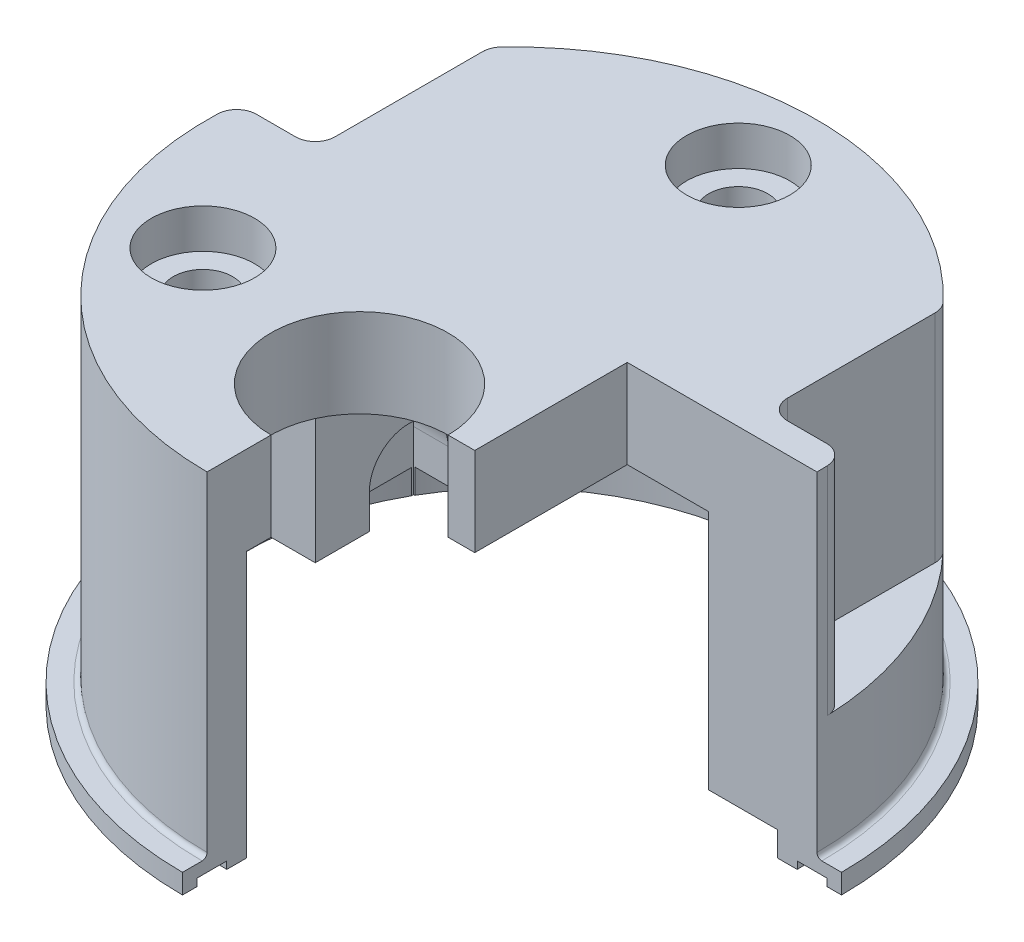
SolidWorks part; units mm, degrees
ref_plane "Face" through (0, 0, 0) normal (0, 0, 1) x (1, 0, 0)
ref_plane "Dessus" through (0, 0, 0) normal (0, 1, 0) x (1, 0, 0)
ref_plane "Droite" through (0, 0, 0) normal (1, 0, 0) x (0, 0, -1)
sketch "Esquisse1" plane through (0, 0, 0) normal (0, 0, 1) x (1, 0, 0)
  line L0 (0, 77.2969) -> (0, -53.1652) construction
  line L1 (-63.5343, 0) -> (62.4031, 0) construction
  line L2 (0, 36) -> (31, 36)
  line L3 (31, 36) -> (31, 2)
  line L4 (31, 2) -> (33.5, 2)
  line L5 (33.5, 2) -> (33.5, 0)
  line L6 (33.5, 0) -> (32, 0)
  line L7 (32, 0) -> (32, 0.75)
  line L8 (32, 0.75) -> (29, 0.75)
  line L9 (29, 0.75) -> (29, 0)
  line L10 (29, 0) -> (27, 0)
  line L11 (27, 0) -> (27, 27)
  line L12 (27, 27) -> (0, 27)
  line L13 (0, 27) -> (0, 36)
  dimension "D1" = 9
  dimension "D2" = 1.5
  dimension "D3" = 3
  dimension "D4" = 2
  dimension "D5" = 4
  dimension "D6" = 6.5
  dimension "D7" = 27
  dimension "D8" = 27
  dimension "D9" = 4
revolve "Base-Révolution" add sketch "Esquisse1" angle 360 about L0
sketch "Esquisse2" plane through (0, 36, 0) normal (0, 1, 0) x (-1, 0, 0)
  line L0 (42.8001, 0) -> (-45.5614, 0) construction
  line L1 (0, -38.1561) -> (0, 39.1602) construction
  line L2 (15.1871, 15.5) -> (-17.6974, 15.5) construction
  circle A0 centre (0, 15.5) radius 9
  dimension "D2" = 18
  dimension "D1" = 15.5
extrude "Enlèv. mat.-Extru.1" cut sketch "Esquisse2" against normal blind 10
sketch "Esquisse7"
  line L0 (0, -33.2189) -> (0, 17.1285) construction
  line L1 (-20, -33.2189) -> (-20, 19.1895) construction
  line L2 (0, 0) -> (-34.9544, 0) construction
  line L3 (-20, -23.5299) -> (-20, 0)
  line L4 (-20, 0) -> (-30.8813, 0)
  line L5 (20, 0) -> (30.8813, 0)
  line L6 (20, -23.5299) -> (20, 0)
  arc A0 (-30.8813, 0) -> (-20, -23.5299) centre (0, 0) ccw
  arc A1 (30.8813, 0) -> (20, -23.5299) centre (0, 0) cw
  dimension "D1" = 20
extrude "Enlèv. mat.-Extru.3" cut sketch "Esquisse4" against normal blind 22
sketch "Esquisse4" plane through (0, 36, 0) normal (0, 1, 0) x (-1, 0, 0)
  line L0 (0, 0) -> (0, -46.4019) construction
  line L1 (0, 0) -> (40.7285, 0) construction
  line L2 (-23, -42.0808) -> (-44.0135, -42.0808)
  line L3 (23, -3) -> (44.0135, -3)
  line L4 (23, -3) -> (23, -42.0808)
  line L5 (23, -42.0808) -> (44.0135, -42.0808)
  line L6 (44.0135, -3) -> (44.0135, -42.0808)
  line L7 (-23, -3) -> (-23, -42.0808)
  line L8 (-23, -3) -> (-44.0135, -3)
  line L9 (-44.0135, -3) -> (-44.0135, -42.0808)
  dimension "D1" = 3
  dimension "D2" = 23
extrude "Boss.-Extru.1" add sketch "Esquisse7" against normal blind 33.5
fillet "Congé1" radius 2
fillet "Congé2" radius 0.5
sketch "Esquisse8" plane through (0, 0, 0) normal (1, 0, 0) x (0, 0, -1)
  line L0 (-15.5, 38.1934) -> (-15.5, 18.6028) construction
  line L1 (-15.5, 27) -> (-15.5, 36) construction
  line L3 (9.5, 41.8102) -> (9.5, -9.6278) construction
  line L4 (-6.2689, 6) -> (23.6039, 6) construction
  line L5 (-27, 0) -> (27, 0) construction
  line L6 (13.5, 6) -> (13.5, -4.6491)
  line L7 (13.5, -4.6491) -> (5.5, -4.6491)
  line L8 (5.5, -4.6491) -> (5.5, 6)
  arc A0 (13.5, 6) -> (5.5, 6) centre (9.5, 6) ccw
  dimension "D3" = 4
  dimension "D1" = 25
  dimension "D2" = 6
extrude "Enlèv. mat.-Extru.4" cut sketch "Esquisse8" against normal mid plane 47
sketch "Esquisse9" plane through (0, 36, 0) normal (0, 1, 0) x (-1, 0, 0)
  line L0 (0, -17.9418) -> (0, -39.9141) construction
  line L1 (8.3859, -23) -> (-15.5366, -23) construction
  circle A0 centre (0, -23) radius 3
  circle A1 centre (-19.9186, 11.5) radius 3
  circle A2 centre (19.9186, 11.5) radius 3
  dimension "D2" = 6
  dimension "D1" = 23
extrude "Enlèv. mat.-Extru.5" cut sketch "Esquisse9" against normal blind 500
sketch "Esquisse10" plane through (0, 36, 0) normal (0, 1, 0) x (-1, 0, 0)
  circle A0 centre (0, -23) radius 5.25
  circle A1 centre (-19.9186, 11.5) radius 5.25
  circle A2 centre (19.9186, 11.5) radius 5.25
  dimension "D1" = 10.5
extrude "Enlèv. mat.-Extru.6" cut sketch "Esquisse10" against normal blind 4
ref_plane "Plan1" through (0, 6, 0) normal (0, -1, 0) x (1, 0, 0)
sketch "Esquisse11" plane through (0, 6, 0) normal (0, -1, 0) x (1, 0, 0)
  point P6 (0, -9.5)
sketch "Esquisse12" plane through (0, 36, 0) normal (0, 1, 0) x (-1, 0, 0)
  line L0 (0, 43.4945) -> (0, 15.5)
  line L1 (0, 15.5) -> (-11.7156, 15.5)
  line L2 (-11.7156, 15.5) -> (-11.7156, 0)
  line L3 (-11.7156, 0) -> (-51.144, 0)
  line L4 (-51.144, 0) -> (-35.9808, 50.1307)
  line L5 (-35.9808, 50.1307) -> (0, 43.4945)
extrude "Enlèv. mat.-Extru.7" cut sketch "Esquisse12" against normal blind 200
